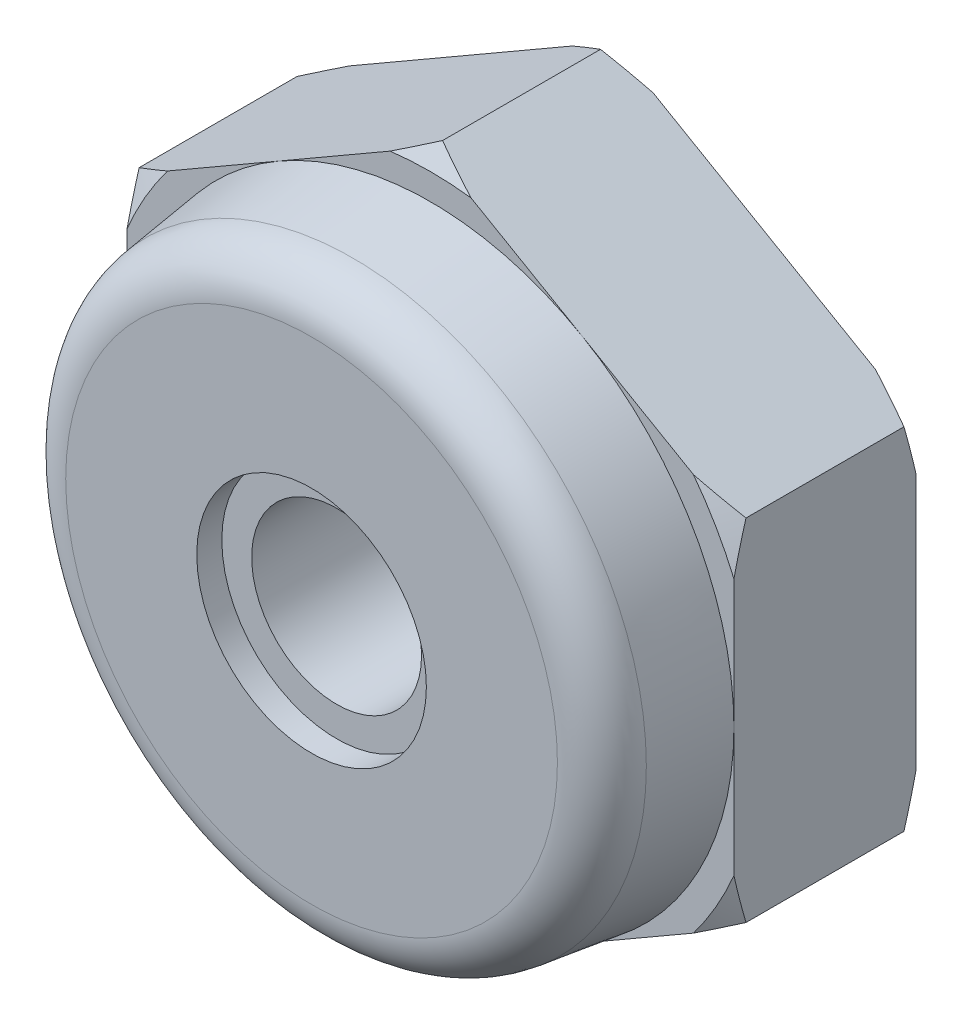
SolidWorks part; units mm, degrees
ref_plane "Front" through (0, 0, 0) normal (0, 0, 1) x (1, 0, 0)
ref_plane "Top" through (0, 0, 0) normal (0, 1, 0) x (1, 0, 0)
ref_plane "Right" through (0, 0, 0) normal (1, 0, 0) x (0, 0, -1)
sketch "BaseNutSke" plane through (0, 0, 0) normal (0, 0, 1) x (1, 0, 0)
  line L1 (3.175, -1.8331) -> (3.175, 1.8331)
  line L2 (3.175, 1.8331) -> (0, 3.6662)
  line L3 (0, 3.6662) -> (-3.175, 1.8331)
  line L4 (-3.175, 1.8331) -> (-3.175, -1.8331)
  line L5 (-3.175, -1.8331) -> (0, -3.6662)
  line L12 (0, -3.6662) -> (3.175, -1.8331)
  circle A0 centre (0, 0) radius 0.889
  circle A2 centre (0, 0) radius 3.175 construction
  dimension "Tap_Drill" = 1.778
  dimension "A" = 6.35
extrude "BaseNut" add sketch "BaseNutSke" against normal blind 1.905
sketch "TorqEleSke" plane through (0, 0, 0) normal (0, 1, 0) x (0, 0, -1)
  line L0 (-9.4809, 0) -> (15.875, 0) construction
  line L1 (0, 0) -> (0, 3.175) construction
  line L2 (-0.9825, 1.2014) -> (-0.9825, 0.889)
  line L3 (0, 0.889) -> (0, 3.175)
  line L4 (0, 3.175) -> (-0.8099, 3.0684)
  line L5 (-0.9825, 0.889) -> (0, 0.889)
  line L6 (-0.9825, 1.2014) -> (-1.2446, 1.2014)
  line L7 (-1.2446, 1.2014) -> (-1.2446, 2.5727)
  line L10 (0, -3.175) -> (0, 0) construction
  line L11 (1.905, -3.175) -> (1.905, 0) construction
  arc A0 (-1.2446, 2.5727) -> (-0.8099, 3.0684) centre (-0.7446, 2.5727) cw
revolve "TorqueElement" add sketch "TorqEleSke" angle 360 about L0
sketch "Sketch3" plane through (0, 0, 0) normal (1, 0, 0) x (0, 0, -1)
  line L0 (1.905, 3.4477) -> (1.7789, 3.6662)
  line L1 (0, 3.6662) -> (0, 3.4477)
  line L2 (1.7789, 3.6662) -> (1.905, 3.6662)
  line L3 (1.905, 3.6662) -> (1.905, 3.4477)
  line L4 (0.1261, 3.6662) -> (0, 3.6662)
  line L5 (0, 3.4477) -> (0.1261, 3.6662)
  line L7 (0, 0) -> (38.6776, 0) construction
  line L9 (0.9525, 4.0415) -> (0.9525, 50004.0415) construction
  line L15 (1.905, 3.6662) -> (0, 3.6662) construction
  point P23 (0.9525, 3.6662)
revolve "DoubleChamfer" cut sketch "Sketch3" angle 360 about L7
sketch "ThdSchSke" plane through (0, 0, 0) normal (0, 1, 0) x (1, 0, 0)
  line L0 (-1.0922, 1.905) -> (-0.889, 2.0223)
  line L1 (-3.175, 1.905) -> (-50003.175, 1.905) construction
  line L2 (-0.889, 2.0223) -> (-0.889, 1.7877)
  line L3 (0.889, 1.905) -> (-0.889, 1.905) construction
  line L4 (-0.889, 1.7877) -> (-1.0922, 1.905)
  line L6 (0, -1.4815) -> (0, -2.9874) construction
  line L7 (-0.889, 1.905) -> (-0.889, -0.9825) construction
revolve "ThreadSchematic" cut sketch "ThdSchSke" angle 360 about L6
pattern_linear "ThdSchPat" [suppressed]
equation "\"Inset_Dia@TorqEleSke\" = \"ThreadSize@ThdSchSke\" * 1.1"
equation "\"D3@TorqEleSke\"=\"ThreadSize@ThdSchSke\" * .12"
equation "\"ChamferLen@Sketch3\" = \"ThreadSize@ThdSchSke\" * .1"
